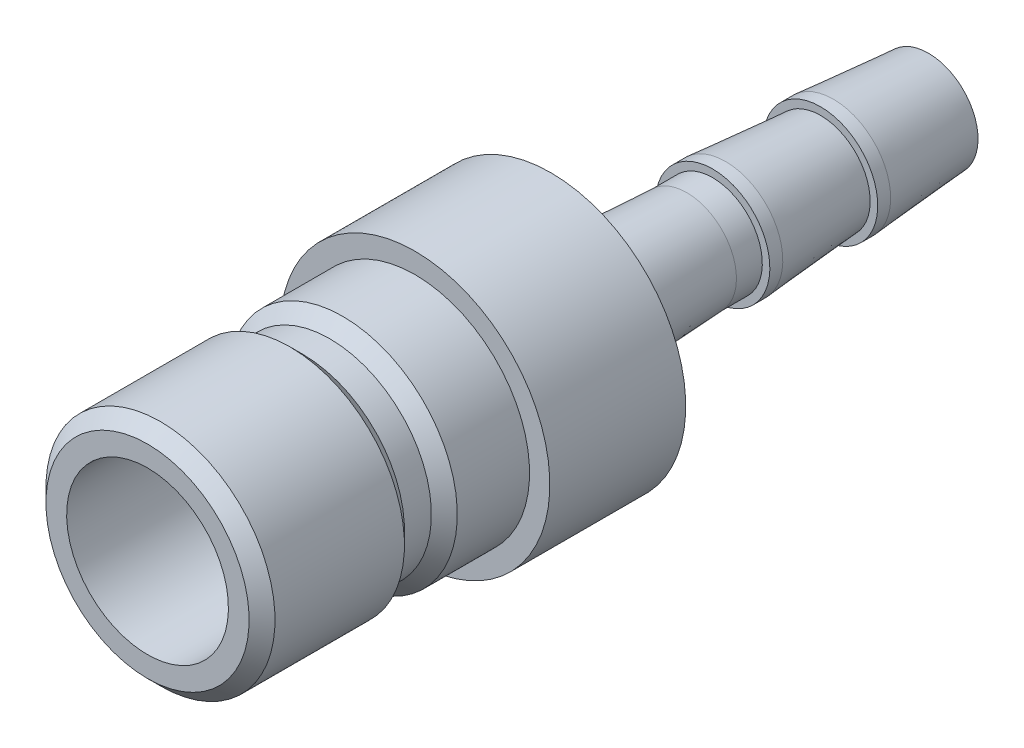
SolidWorks part; units mm, degrees
ref_plane "Front Plane" through (0, 0, 0) normal (0, 0, 1) x (1, 0, 0)
ref_plane "Top Plane" through (0, 0, 0) normal (0, 1, 0) x (1, 0, 0)
ref_plane "Right Plane" through (0, 0, 0) normal (1, 0, 0) x (0, 0, -1)
sketch "Sketch1" plane through (0, 0, 0) normal (1, 0, 0) x (0, 0, -1)
  line L0 (0, 0) -> (-18.923, 0) construction
  line L1 (-15.748, 4.7625) -> (-15.748, 5.9817)
  line L2 (-6.604, 5.9817) -> (-6.604, 0) construction
  line L3 (-14.986, 6.7437) -> (-7.366, 6.7437)
  line L4 (0, 7.9375) -> (0, 0) construction
  line L5 (-6.604, 5.9817) -> (-5.0165, 5.9817)
  line L6 (-4.2545, 6.7437) -> (0, 6.7437)
  line L7 (0, 6.7437) -> (0, 7.9375)
  line L8 (-6.604, 5.9817) -> (-7.366, 6.7437)
  line L9 (-5.0165, 5.9817) -> (-4.2545, 6.7437)
  line L10 (-15.748, 5.9817) -> (-14.986, 6.7437)
  line L11 (-15.748, 4.7625) -> (-3.556, 4.7625)
  line L12 (0, 7.9375) -> (8.001, 7.9375)
  line L13 (24.638, 3.3655) -> (23.876, 3.3655)
  line L14 (30.226, 2.921) -> (30.226, 2.3813)
  line L15 (0, 0) -> (4.445, 0) construction
  line L16 (23.876, 3.3655) -> (23.876, 2.921)
  line L17 (-0.6919, 2.3812) -> (30.226, 2.3813)
  line L18 (-3.556, 4.7625) -> (-0.6919, 2.3812)
  line L19 (30.226, 2.921) -> (24.638, 3.3655)
  line L20 (18.288, 3.3655) -> (17.526, 3.3655)
  line L21 (23.876, 2.921) -> (18.288, 3.3655)
  line L23 (17.526, 2.921) -> (16.002, 2.921)
  line L24 (16.002, 2.921) -> (8.001, 3.3655)
  line L25 (8.001, 3.3655) -> (8.001, 7.9375)
  line L26 (17.526, 3.3655) -> (17.526, 2.921)
  point P4 (17.526, 2.8442)
  point P14 (0, 0)
  dimension "D1" = 15.748
  dimension "D2" = 1.5875
  dimension "D3" = 0.762
  dimension "D4" = 45
  dimension "D5" = 9.144
  dimension "D6" = 45
  dimension "D7" = 15.875
  dimension "D8" = 22.225
  dimension "D9" = 45.974
  dimension "D10" = 6.35
  dimension "D11" = 9.525
  dimension "D12" = 0.762
  dimension "D13" = 6.731
  dimension "D14" = 13.4874
  dimension "D15" = 4.7625
  dimension "D16" = 12.192
  dimension "D17" = 5.842
  dimension "D18" = 1.524
revolve "Revolve1" add sketch "Sketch1" angle 360 about L0
